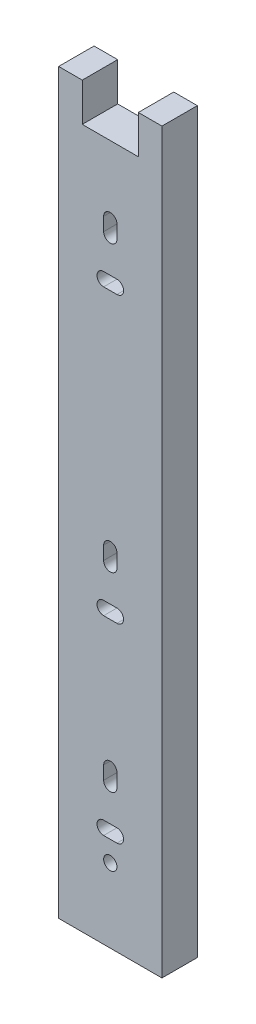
SolidWorks part; units mm, degrees
ref_plane "Front Plane" through (0, 0, 0) normal (0, 0, 1) x (1, 0, 0)
ref_plane "Top Plane" through (0, 0, 0) normal (0, 1, 0) x (1, 0, 0)
ref_plane "Right Plane" through (0, 0, 0) normal (1, 0, 0) x (0, 0, -1)
sketch "Sketch1" plane through (0, 0, 0) normal (0, 0, 1) x (1, 0, 0)
  line L1 (-20.4494, 228.4363) -> (14.5506, 228.4363)
  line L2 (-20.4494, 228.4363) -> (-20.4494, -21.5637)
  line L3 (-20.4494, -21.5637) -> (14.5506, -21.5637)
  line L4 (14.5506, 228.4363) -> (14.5506, -21.5637)
  dimension "D1" = 35
  dimension "D2" = 250
extrude "Boss-Extrude1" add sketch "Sketch1" along normal blind 12
sketch "Sketch2" plane through (0, 0, 0) normal (0, 0, 1) x (1, 0, 0)
  line L0 (14.5506, 228.4363) -> (-20.4494, 228.4363) construction
  line L1 (-12.4494, 228.4363) -> (6.5506, 228.4363)
  line L2 (-12.4494, 228.4363) -> (-12.4494, 215.4363)
  line L3 (-12.4494, 215.4363) -> (6.5506, 215.4363)
  line L4 (6.5506, 228.4363) -> (6.5506, 215.4363)
  line L5 (14.5506, -21.5637) -> (14.5506, 228.4363) construction
  line L6 (-20.4494, 228.4363) -> (-20.4494, -21.5637) construction
  dimension "D1" = 13
  dimension "D2" = 8
  dimension "D3" = 8
extrude "Cut-Extrude1" cut sketch "Sketch2" along normal blind 25
ref_plane "Plane1" through (0, 0, 12) normal (0, 0, 1) x (1, 0, 0)
sketch "Sketch3" plane through (0, 0, 12) normal (0, 0, 1) x (1, 0, 0)
  line L0 (-20.4494, -21.5637) -> (14.5506, -21.5637) construction
  line L1 (-20.4494, 228.4363) -> (-20.4494, -21.5637) construction
  line L2 (-5.1994, 77.1363) -> (-0.6994, 77.1363) construction
  line L3 (-5.1994, 12.6363) -> (-0.6994, 12.6363) construction
  line L4 (-5.1994, 14.8863) -> (-0.6994, 14.8863)
  line L5 (-5.1994, 10.3863) -> (-0.6994, 10.3863)
  line L6 (-2.9494, 31.0863) -> (-2.9494, 26.5863) construction
  line L7 (-0.6994, 31.0863) -> (-0.6994, 26.5863)
  line L8 (-5.1994, 31.0863) -> (-5.1994, 26.5863)
  line L9 (14.5506, -21.5637) -> (14.5506, 228.4363) construction
  line L10 (-5.1994, 79.3863) -> (-0.6994, 79.3863)
  line L11 (-5.1994, 74.8863) -> (-0.6994, 74.8863)
  line L12 (-2.9494, 95.5863) -> (-2.9494, 91.0863) construction
  line L13 (-0.6994, 95.5863) -> (-0.6994, 91.0863)
  line L14 (-5.1994, 95.5863) -> (-5.1994, 91.0863)
  line L15 (-5.1994, 173.6363) -> (-0.6994, 173.6363) construction
  line L16 (-5.1994, 175.8863) -> (-0.6994, 175.8863)
  line L17 (-5.1994, 171.3863) -> (-0.6994, 171.3863)
  line L18 (-2.9494, 192.0863) -> (-2.9494, 187.5863) construction
  line L19 (-0.6994, 192.0863) -> (-0.6994, 187.5863)
  line L20 (-5.1994, 192.0863) -> (-5.1994, 187.5863)
  circle A0 centre (-2.9494, 3.4363) radius 2.25
  arc A1 (-5.1994, 14.8863) -> (-5.1994, 10.3863) centre (-5.1994, 12.6363) ccw
  arc A2 (-0.6994, 10.3863) -> (-0.6994, 14.8863) centre (-0.6994, 12.6363) ccw
  arc A3 (-0.6994, 31.0863) -> (-5.1994, 31.0863) centre (-2.9494, 31.0863) ccw
  arc A4 (-5.1994, 26.5863) -> (-0.6994, 26.5863) centre (-2.9494, 26.5863) ccw
  arc A5 (-5.1994, 79.3863) -> (-5.1994, 74.8863) centre (-5.1994, 77.1363) ccw
  arc A6 (-0.6994, 74.8863) -> (-0.6994, 79.3863) centre (-0.6994, 77.1363) ccw
  arc A7 (-0.6994, 95.5863) -> (-5.1994, 95.5863) centre (-2.9494, 95.5863) ccw
  arc A8 (-5.1994, 91.0863) -> (-0.6994, 91.0863) centre (-2.9494, 91.0863) ccw
  arc A9 (-5.1994, 175.8863) -> (-5.1994, 171.3863) centre (-5.1994, 173.6363) ccw
  arc A10 (-0.6994, 171.3863) -> (-0.6994, 175.8863) centre (-0.6994, 173.6363) ccw
  arc A11 (-0.6994, 192.0863) -> (-5.1994, 192.0863) centre (-2.9494, 192.0863) ccw
  arc A12 (-5.1994, 187.5863) -> (-0.6994, 187.5863) centre (-2.9494, 187.5863) ccw
  point P8 (-2.9494, 12.6363)
  point P15 (-2.9494, 28.8363)
  point P20 (-7.4494, 12.6363)
  point P21 (1.5506, 12.6363)
  point P24 (-2.9494, 33.3363)
  point P25 (-2.9494, 24.3363)
  point P37 (-2.9494, 77.1363)
  point P44 (-2.9494, 93.3363)
  point P49 (-7.4494, 77.1363)
  point P50 (1.5506, 77.1363)
  point P51 (-2.9494, 97.8363)
  point P52 (-2.9494, 88.8363)
  point P55 (-2.9494, 173.6363)
  point P62 (-2.9494, 189.8363)
  point P67 (-7.4494, 173.6363)
  point P68 (1.5506, 173.6363)
  point P69 (-2.9494, 194.3363)
  point P70 (-2.9494, 185.3363)
  dimension "D1" = 4.5
  dimension "D2" = 25
  dimension "D3" = 17.5
  dimension "D4" = 9.2
  dimension "D5" = 4.5
  dimension "D6" = 9
  dimension "D7" = 17.5
  dimension "D8" = 9
  dimension "D9" = 4.5
  dimension "D10" = 17.5
  dimension "D11" = 16.2
  dimension "D12" = 9
  dimension "D13" = 4.5
  dimension "D14" = 9
  dimension "D15" = 4.5
  dimension "D16" = 17.5
  dimension "D17" = 17.5
  dimension "D18" = 17.5
  dimension "D19" = 17.5
  dimension "D20" = 4.5
  dimension "D21" = 9
  dimension "D22" = 4.5
  dimension "D23" = 9
  dimension "D24" = 16.2
  dimension "D25" = 16.2
  dimension "D26" = 60
  dimension "D27" = 92
extrude "Cut-Extrude2" cut sketch "Sketch3" against normal blind 21
sketch "Sketch4" plane through (0, 0, 0) normal (0, 0, 1) x (1, 0, 0)
  line L0 (-20.4494, 228.4363) -> (-20.4494, -21.5637) construction
  line L3 (-0.6994, 79.3863) -> (-5.1994, 79.3863) construction
  line L4 (-0.6994, 175.8863) -> (-5.1994, 175.8863) construction
  circle A0 centre (-0.4494, 173.6363) radius 1.7
  circle A1 centre (-0.4494, 77.1363) radius 1.7
  dimension "D1" = 3.4
  dimension "D2" = 3.4
  dimension "D3" = 20
  dimension "D4" = 20
  dimension "D5" = 2.25
  dimension "D6" = 2.25
